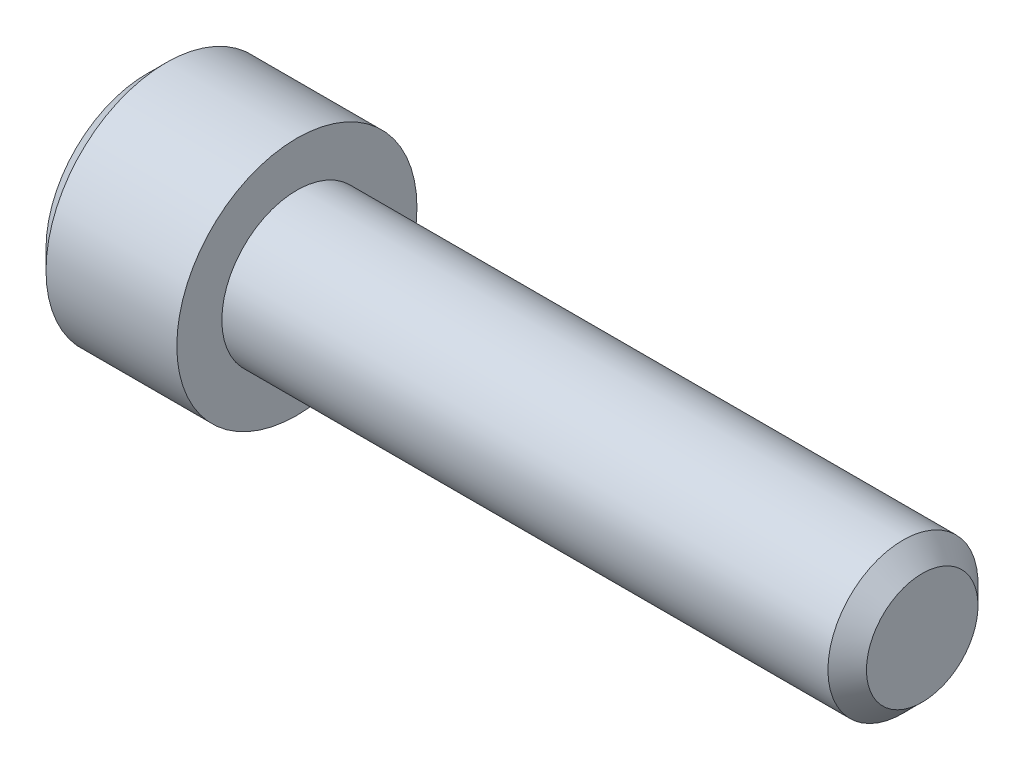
SolidWorks part; units mm, degrees
ref_plane "Plane1" through (0, 0, 0) normal (0, 0, 1) x (1, 0, 0)
ref_plane "Plane2" through (0, 0, 0) normal (0, 1, 0) x (1, 0, 0)
ref_plane "Plane3" through (0, 0, 0) normal (1, 0, 0) x (0, 0, -1)
sketch "Sketch1" plane through (0, 0, 0) normal (0, 0, 1) x (1, 0, 0)
  line L0 (0, 0.762) -> (6.1544, 0.762)
  line L1 (6.1544, 0.762) -> (6.35, 0.5664)
  line L2 (6.35, 0.5664) -> (6.35, 0)
  line L3 (0, 0.762) -> (0, 1.2192)
  line L4 (0, 1.2192) -> (-1.3284, 1.2192)
  line L5 (-1.3284, 1.2192) -> (-1.524, 1.0236)
  line L6 (-1.524, 1.0236) -> (-1.524, 0)
  line L7 (-51.524, 0) -> (218.476, 0) construction
  line L8 (6.35, 0) -> (-1.524, 0)
  dimension "S_Chamfer" = 0.1956
  dimension "S2" = 0.1956
  dimension "H_HeadHight" = 1.524
  dimension "L_BodyLength" = 6.35
  dimension "S3" = 0.1956
  dimension "S4" = 0.1956
  dimension "H2" = 1.524
  dimension "L2" = 6.35
  dimension "D_BodyDiameter" = 1.524
  dimension "A_HeadDiameter" = 2.4384
revolve "Base-Revolve" add sketch "Sketch1" angle 360 about L7
sketch "Sketch3" plane through (-1.524, 0, 0) normal (-1, 0, 0) x (0, 0, 1)
  line L0 (-0.3666, 0.635) -> (0.3666, 0.635)
  line L1 (0.3666, 0.635) -> (0.7332, 0)
  line L2 (-0.3666, 0.635) -> (-0.7332, 0)
  line L3 (-0.3666, -0.635) -> (0.3666, -0.635)
  line L4 (0.3666, -0.635) -> (0.7332, 0)
  line L5 (-0.3666, -0.635) -> (-0.7332, 0)
  line L6 (0.7332, 0) -> (-0.7332, 0) construction
  line L7 (-0.3666, 0.635) -> (0.3666, -0.635) construction
  line L8 (0.3666, 0.635) -> (-0.3666, -0.635) construction
  line L9 (0, 1.0236) -> (0, -1.0236) construction
  line L10 (-1.0236, 0) -> (1.0236, 0) construction
  circle A1 centre (0, 0) radius 1.0236 construction
  point P1 (0, 0)
  point P15 (0, 0)
  dimension "J_HexagonSocketSize" = 1.27
extrude "Cut-Extrude1" cut sketch "Sketch3" against normal blind 0.635
equation "\"S2@Sketch1\" = \"S_Chamfer@Sketch1\""
equation "\"S3@Sketch1\" = \"S_Chamfer@Sketch1\""
equation "\"S4@Sketch1\" = \"S_Chamfer@Sketch1\""
equation "\"H2@Sketch1\" = \"H_HeadHight@Sketch1\""
equation "\"L2@Sketch1\" = \"L_BodyLength@Sketch1\""
